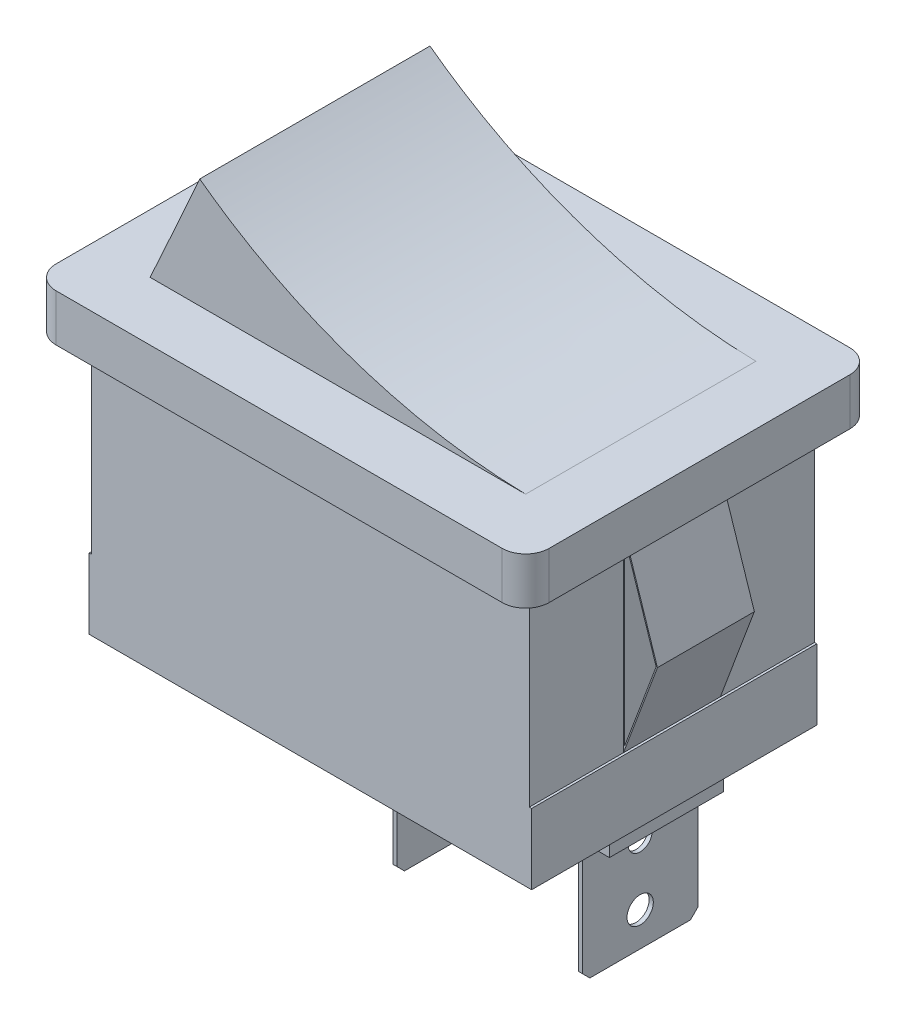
SolidWorks part; units mm, degrees
ref_plane "Front Plane" through (0, 0, 0) normal (0, 0, 1) x (1, 0, 0)
ref_plane "Top Plane" through (0, 0, 0) normal (0, 1, 0) x (1, 0, 0)
ref_plane "Right Plane" through (0, 0, 0) normal (1, 0, 0) x (0, 0, -1)
sketch "Sketch1" plane through (0, 0, 0) normal (0, 1, 0) x (1, 0, 0)
  line L1 (9.425, -6.075) -> (-9.425, -6.075)
  line L2 (9.425, -6.075) -> (9.425, 6.075)
  line L3 (9.425, 6.075) -> (-9.425, 6.075)
  line L4 (-9.425, -6.075) -> (-9.425, 6.075)
  line L5 (9.425, -6.075) -> (-9.425, 6.075) construction
  line L6 (9.425, 6.075) -> (-9.425, -6.075) construction
  point P0 (0, 0)
  dimension "D1" = 18.85
  dimension "D2" = 12.15
extrude "Boss-Extrude1" add sketch "Sketch1" along normal blind 11.3
sketch "Sketch2" plane through (0, 11.3, 0) normal (0, 1, 0) x (1, 0, 0)
  line L1 (9.5, -7.405) -> (-9.5, -7.405)
  line L2 (10.5, -6.405) -> (10.5, 6.405)
  line L3 (9.5, 7.405) -> (-9.5, 7.405)
  line L4 (-10.5, -6.405) -> (-10.5, 6.405)
  line L5 (10.5, -7.405) -> (-10.5, 7.405) construction
  line L6 (10.5, 7.405) -> (-10.5, -7.405) construction
  arc A0 (10.5, 6.405) -> (9.5, 7.405) centre (9.5, 6.405) ccw
  arc A1 (9.5, -7.405) -> (10.5, -6.405) centre (9.5, -6.405) ccw
  arc A2 (-9.5, -7.405) -> (-10.5, -6.405) centre (-9.5, -6.405) cw
  arc A3 (-9.5, 7.405) -> (-10.5, 6.405) centre (-9.5, 6.405) ccw
  point P0 (0, 0)
  dimension "D3" = 1
  dimension "D1" = 14.81
  dimension "D2" = 21
extrude "Boss-Extrude2" add sketch "Sketch2" along normal blind 2
sketch "Sketch4" plane through (0, 0, 0) normal (0, 0, 1) x (1, 0, 0)
  line L0 (-8, 13.3) -> (8, 13.3)
  line L1 (-10.5, 13.3) -> (-10.5, 11.3) construction
  line L2 (10.5, 13.3) -> (10.5, 11.3) construction
  line L3 (-9.5, 13.3) -> (9.5, 13.3) construction
  spline S0 degree 2 poles (-8, 13.3) (-6.9294, 15.6379) (-5.8858, 17.988) knots 0 0 0 1 1 1
  spline S1 degree 3 poles (-5.8858, 17.988) (-1.9189, 15.0438) (3.0656, 13.3904) (8, 13.3) knots 0 0 0 0 1 1 1 1
  dimension "D3" = 5.1427
  dimension "D4" = 14.8883
  dimension "D5" = 4.688
  dimension "D1" = 2.5
  dimension "D2" = 2.5
extrude "Boss-Extrude4" add sketch "Sketch4" along normal mid plane 9.81 separate body
sketch "Sketch5" plane through (9.425, 0, 0) normal (1, 0, 0) x (0, 0, -1)
  line L0 (-6.075, 0) -> (6.075, 0) construction
  line L1 (-6.075, 11.3) -> (6.075, 11.3)
  line L2 (-6.075, 11.3) -> (-6.075, 3)
  line L3 (-6.075, 3) -> (6.075, 3)
  line L4 (6.075, 11.3) -> (6.075, 3)
  line L5 (6.075, 11.3) -> (6.075, 0) construction
  line L6 (-6.075, 11.3) -> (-6.075, 0) construction
  line L7 (-6.075, 11.3) -> (6.075, 11.3) construction
  dimension "D1" = 3
extrude "Cut-Extrude2" cut sketch "Sketch5" against normal blind 0.1
mirror "Mirror1" about plane through (0, 0, 0) normal (1, 0, 0) of "Cut-Extrude2"
sketch "Sketch6" plane through (0, 0, 0) normal (0, 0, 1) x (1, 0, 0)
  line L0 (9.325, 3) -> (10.775, 6.8671)
  line L1 (10.775, 6.8671) -> (9.325, 11.3)
  line L2 (9.325, 11.3) -> (9.325, 3)
  line L3 (10.722, 6.8682) -> (9.375, 10.9863)
  line L4 (9.375, 10.9863) -> (9.375, 3.2758)
  line L5 (9.375, 3.2758) -> (10.722, 6.8682)
  dimension "D1" = 1.45
  dimension "D2" = 4.13
  dimension "D3" = 0.05
extrude "Boss-Extrude5" add sketch "Sketch6" along normal mid plane 4.13
mirror "Mirror2" about plane through (0, 0, 0) normal (1, 0, 0) of "Boss-Extrude5"
sketch "Sketch7" plane through (0, 0, 0) normal (0, -1, 0) x (1, 0, 0)
  line L0 (0, 0) -> (-2.5011, 0) construction
  line L1 (-9.125, 2.43) -> (-8.005, 2.43)
  line L2 (-9.125, 2.43) -> (-9.125, -2.43)
  line L3 (-9.125, -2.43) -> (-8.005, -2.43)
  line L4 (-8.005, 2.43) -> (-8.005, -2.43)
  line L5 (9.8934, 0) -> (-9.8934, 0) construction
  line L7 (-9.425, -6.075) -> (-9.425, 6.075) construction
  line L8 (-7.825, 2.43) -> (-6.705, 2.43)
  line L9 (-7.825, 2.43) -> (-7.825, -2.43)
  line L10 (-7.825, -2.43) -> (-6.705, -2.43)
  line L11 (-6.705, 2.43) -> (-6.705, -2.43)
  dimension "D1" = 4.86
  dimension "D2" = 1.12
  dimension "D3" = 0.3
  dimension "D5" = 0.18
  dimension "D4" = 2
extrude "Boss-Extrude6" add sketch "Sketch7" along normal blind 0.8
pattern_linear "LPattern1" count 3 spacing 7.9 along (1, 0, 0) of "Boss-Extrude6"
sketch "Sketch8" plane through (7.795, 0, 0) normal (1, 0, 0) x (0, 0, -1)
  line L0 (2.7628, 0) -> (2.7628, -0.2369)
  line L1 (-6.075, 0) -> (6.075, 0) construction
  line L2 (2.7628, -0.2369) -> (2.6024, -0.2369)
  line L3 (0, 0) -> (0, -2.3273) construction
  line L4 (-2.4577, -0.9458) -> (-2.4577, -5.6317)
  line L5 (2.4577, -0.0947) -> (2.4577, -0.8273)
  line L6 (2.4577, -0.8273) -> (2.35, -0.8273)
  line L7 (2.6024, -0.2369) -> (2.4577, -0.0947)
  line L8 (2.35, -0.9458) -> (2.4577, -0.9458)
  line L9 (2.4577, -0.9458) -> (2.4577, -5.6317)
  line L10 (-2.35, -0.9458) -> (-2.4577, -0.9458)
  line L11 (-2.6024, -0.2369) -> (-2.4577, -0.0947)
  line L12 (-2.4577, -0.8273) -> (-2.35, -0.8273)
  line L13 (-2.4577, -0.0947) -> (-2.4577, -0.8273)
  line L14 (-2.7628, -0.2369) -> (-2.6024, -0.2369)
  line L15 (-2.7628, 0) -> (-2.7628, -0.2369)
  line L16 (2.1436, -5.9458) -> (-2.1436, -5.9458)
  line L17 (2.7628, 0) -> (-2.7628, 0)
  line L18 (2.4577, -5.6317) -> (2.1436, -5.9458)
  line L19 (-2.4577, -5.6317) -> (-2.1436, -5.9458)
  arc A0 (2.35, -0.8273) -> (2.35, -0.9458) centre (2.3986, -0.8865) ccw
  arc A1 (-2.35, -0.8273) -> (-2.35, -0.9458) centre (-2.3986, -0.8865) cw
  dimension "D11" = 0.0767
  dimension "D1" = 4.6859
  dimension "D2" = 5.9458
  dimension "D3" = 4.9154
  dimension "D4" = 5.5255
  dimension "D5" = 0.7325
  dimension "D6" = 4.9154
  dimension "D7" = 0.1604
  dimension "D8" = 0.2369
  dimension "D9" = 0.0947
  dimension "D10" = 0.1077
  dimension "D12" = 0.1185
  dimension "D13" = 0.0592
  dimension "D14" = 0.3141
extrude "Boss-Extrude7" add sketch "Sketch8" along normal blind 0.18
sketch "Sketch9" plane through (7.975, 0, 0) normal (1, 0, 0) x (0, 0, -1)
  line L0 (-2.4577, -0.9458) -> (-2.4577, -5.6317) construction
  circle A0 centre (0, -1.8519) radius 0.5132
  circle A1 centre (0, -4.5006) radius 0.5598
  point P7 (0, 0)
  point P8 (0, 0)
  point P9 (0, 0)
  dimension "D1" = 1.0264
  dimension "D5" = 1.1197
  dimension "D2" = 1.8519
  dimension "D3" = 2.4577
  dimension "D4" = 2.6487
extrude "Cut-Extrude3" cut sketch "Sketch9" against normal up to next (0.18 mm away)
pattern_linear "LPattern11" count 2 spacing 7.9 along (-1, 0, 0) of "Boss-Extrude7", "Cut-Extrude3"
